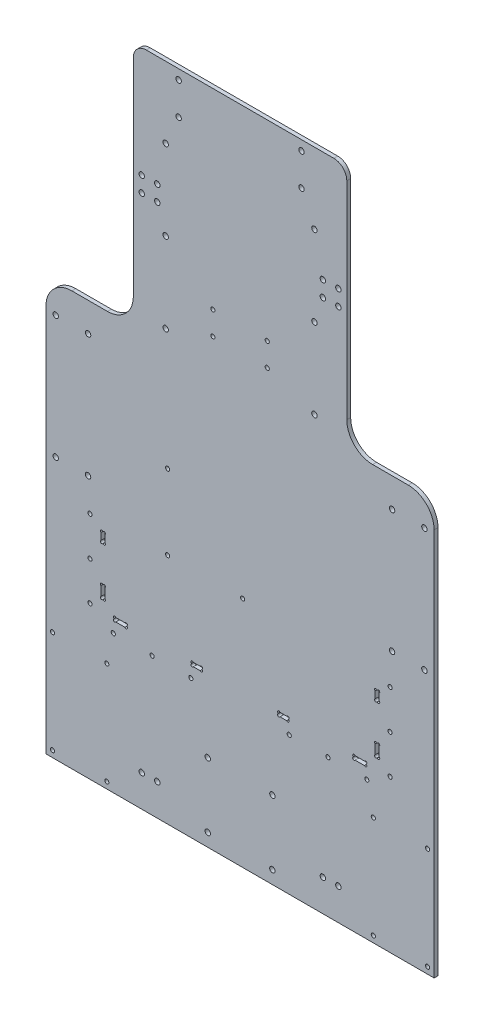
SolidWorks part; units mm, degrees
ref_plane "前视基准面" through (0, 0, 0) normal (0, 0, 1) x (1, 0, 0)
ref_plane "上视基准面" through (0, 0, 0) normal (0, 1, 0) x (1, 0, 0)
ref_plane "右视基准面" through (0, 0, 0) normal (1, 0, 0) x (0, 0, -1)
sketch "草图1" plane through (0, 0, 0) normal (0, 0, 1) x (1, 0, 0)
  line L1 (-82.5, -255) -> (82.5, -255)
  line L2 (-82.5, -255) -> (-82.5, 255)
  line L3 (-82.5, 255) -> (82.5, 255)
  line L4 (82.5, -255) -> (82.5, 255)
  line L5 (-82.5, -255) -> (82.5, 255) construction
  line L6 (-82.5, 255) -> (82.5, -255) construction
  point P0 (0, 0)
  dimension "D1" = 510
  dimension "D2" = 165
extrude "凸台-拉伸1" add sketch "草图1" along normal blind 3
hole_wizard "Ø4.2 (4.2) 直径孔1" positions "草图2" profile "草图3" hole size "Ø4.2" standard "GB"
sketch "草图2" plane through (0, 0, 3) normal (0, 0, 1) x (1, 0, 0)
  line L0 (0, 255) -> (0, -255) construction
  line L1 (82.5, 255) -> (-82.5, 255) construction
  line L2 (-82.5, -255) -> (82.5, -255) construction
  point P9 (25, -245)
  point P12 (25, -195)
  point P16 (-25, -195)
  point P17 (-25, -245)
  dimension "D1" = 10
  dimension "D2" = 50
  dimension "D3" = 50
sketch "草图3" plane through (-25, -245, 3) normal (1, 0, 0) x (0, -1, 0)
  line L0 (0, 0) -> (0, 3)
  line L1 (0, 3) -> (2.1, 3)
  line L2 (2.1, 3) -> (2.1, 0)
  line L5 (2.1, 0) -> (0, 0)
  line L11 (0, -6.35) -> (0, 107.95) construction
  dimension "通孔孔直径" = 4.2
  dimension "通孔孔深度" = 3
hole_wizard "Ø4.2 (4.2) 直径孔2" positions "草图4" profile "草图5" hole size "Ø4.2" standard "GB"
sketch "草图4" plane through (0, 0, 3) normal (0, 0, 1) x (1, 0, 0)
  line L0 (0, 255) -> (0, -255) construction
  line L1 (82.5, 255) -> (-82.5, 255) construction
  line L2 (-82.5, -255) -> (82.5, -255) construction
  point P8 (-47.5, 247.5)
  point P11 (-47.5, 222.5)
  point P15 (47.5, 222.5)
  point P16 (47.5, 247.5)
  dimension "D1" = 95
  dimension "D2" = 7.5
  dimension "D3" = 25
sketch "草图5" plane through (47.5, 247.5, 3) normal (1, 0, 0) x (0, -1, 0)
  line L0 (0, 0) -> (0, 3)
  line L1 (0, 3) -> (2.1, 3)
  line L2 (2.1, 3) -> (2.1, 0)
  line L5 (2.1, 0) -> (0, 0)
  line L11 (0, -6.35) -> (0, 107.95) construction
  dimension "通孔孔直径" = 4.2
  dimension "通孔孔深度" = 3
sketch "草图6" plane through (0, 0, 3) normal (0, 0, 1) x (1, 0, 0)
  line L0 (0, 255) -> (0, -255) construction
  line L1 (-82.5, -255) -> (-150, -255)
  line L2 (-82.5, -255) -> (-82.5, 65)
  line L3 (-82.5, 65) -> (-150, 65)
  line L4 (-150, -255) -> (-150, 65)
  line L5 (82.5, 255) -> (-82.5, 255) construction
  line L6 (-82.5, -255) -> (82.5, -255) construction
  line L7 (150, -255) -> (150, 65)
  line L8 (82.5, 65) -> (150, 65)
  line L9 (82.5, -255) -> (82.5, 65)
  line L10 (82.5, -255) -> (150, -255)
  dimension "D1" = 320
  dimension "D2" = 300
extrude "凸台-拉伸2" add sketch "草图6" against normal blind 3
hole_wizard "Ø4.2 (4.2) 直径孔3" positions "草图9" profile "草图10" hole size "Ø4.2" standard "GB"
sketch "草图9" plane through (0, 0, 3) normal (0, 0, 1) x (1, 0, 0)
  line L0 (-150, -5) -> (150, -5) construction
  line L1 (-150, 65) -> (-150, -255) construction
  line L2 (150, -255) -> (150, 65) construction
  line L4 (-150, -255) -> (150, -255) construction
  line L5 (0, 255) -> (0, -255) construction
  line L6 (82.5, 255) -> (-82.5, 255) construction
  point P11 (-142.5, 42.5)
  point P19 (-142.5, -52.5)
  point P20 (-117.5, 42.5)
  point P25 (-117.5, -52.5)
  point P26 (117.5, -52.5)
  point P27 (117.5, 42.5)
  point P28 (142.5, -52.5)
  point P29 (142.5, 42.5)
  dimension "D1" = 250
  dimension "D2" = 95
  dimension "D3" = 285
  dimension "D4" = 25
sketch "草图10" plane through (142.5, 42.5, 3) normal (1, 0, 0) x (0, -1, 0)
  line L0 (0, 0) -> (0, 3)
  line L1 (0, 3) -> (2.1, 3)
  line L2 (2.1, 3) -> (2.1, 0)
  line L5 (2.1, 0) -> (0, 0)
  line L11 (0, -6.35) -> (0, 107.95) construction
  dimension "通孔孔直径" = 4.2
  dimension "通孔孔深度" = 3
hole_wizard "Ø4.2 (4.2) 直径孔4" positions "草图11" profile "草图12" hole size "Ø4.2" standard "GB"
sketch "草图11" plane through (0, 0, 3) normal (0, 0, 1) x (1, 0, 0)
  line L0 (0, 255) -> (0, -255) construction
  line L1 (82.5, 255) -> (-82.5, 255) construction
  line L2 (-150, -255) -> (150, -255) construction
  line L4 (-150, -230.5) -> (150, -230.5) construction
  line L5 (-150, 65) -> (-150, -255) construction
  line L6 (150, -255) -> (150, 65) construction
  point P17 (76, -230.5)
  point P20 (64, -230.5)
  point P23 (-64, -230.5)
  point P24 (-76, -230.5)
  point P25 (76, 169.5)
  point P29 (64, 169.5)
  point P31 (-64, 169.5)
  point P33 (-76, 169.5)
  point P35 (76, 157.5)
  point P39 (-76, 157.5)
  point P40 (-64, 157.5)
  point P42 (64, 157.5)
  dimension "D1" = 24.5
  dimension "D2" = 152
  dimension "D3" = 128
  dimension "D4" = 400
  dimension "D5" = 12
sketch "草图12" plane through (64, 157.5, 3) normal (1, 0, 0) x (0, -1, 0)
  line L0 (0, 0) -> (0, 3)
  line L1 (0, 3) -> (2.1, 3)
  line L2 (2.1, 3) -> (2.1, 0)
  line L5 (2.1, 0) -> (0, 0)
  line L11 (0, -6.35) -> (0, 107.95) construction
  dimension "通孔孔直径" = 4.2
  dimension "通孔孔深度" = 3
hole_wizard "Ø4.2 (4.2) 直径孔5" positions "草图13" profile "草图14" hole size "Ø4.2" standard "GB"
sketch "草图13" plane through (0, 0, 3) normal (0, 0, 1) x (1, 0, 0)
  line L0 (0, 255) -> (0, -255) construction
  line L1 (82.5, 255) -> (-82.5, 255) construction
  line L2 (-150, -255) -> (150, -255) construction
  point P9 (57.5, 200)
  point P12 (57.5, 138)
  point P16 (57.5, 76)
  point P19 (-57.5, 76)
  point P20 (-57.5, 138)
  point P21 (-57.5, 200)
  dimension "D1" = 55
  dimension "D2" = 115
  dimension "D3" = 62
  dimension "D4" = 62
sketch "草图14" plane through (-57.5, 200, 3) normal (1, 0, 0) x (0, -1, 0)
  line L0 (0, 0) -> (0, 3)
  line L1 (0, 3) -> (2.1, 3)
  line L2 (2.1, 3) -> (2.1, 0)
  line L5 (2.1, 0) -> (0, 0)
  line L11 (0, -6.35) -> (0, 107.95) construction
  dimension "通孔孔直径" = 4.2
  dimension "通孔孔深度" = 3
hole_wizard "Ø3.2 (3.2) 直径孔1" positions "草图15" profile "草图16" hole size "Ø3.2" standard "GB"
sketch "草图15" plane through (0, 0, 3) normal (0, 0, 1) x (1, 0, 0)
  point P0 (2, -75)
  point P3 (-56, -75)
  point P6 (-56, -17)
sketch "草图16" plane through (2, -75, 3) normal (1, 0, 0) x (0, -1, 0)
  line L0 (0, 0) -> (0, 3)
  line L1 (0, 3) -> (1.6, 3)
  line L2 (1.6, 3) -> (1.6, 0)
  line L5 (1.6, 0) -> (0, 0)
  line L11 (0, -6.35) -> (0, 107.95) construction
  dimension "通孔孔直径" = 3.2
  dimension "通孔孔深度" = 3
hole_wizard "Ø3.2 (3.2) 直径孔2" positions "草图17" profile "草图18" hole size "Ø3.2" standard "GB"
sketch "草图17" plane through (0, 0, 3) normal (0, 0, 1) x (1, 0, 0)
  point P4 (21, 89)
  point P7 (21, 107)
  point P14 (-21, 89)
  point P17 (-21, 107)
sketch "草图18" plane through (21, 89, 3) normal (1, 0, 0) x (0, -1, 0)
  line L0 (0, 0) -> (0, 3)
  line L1 (0, 3) -> (1.6, 3)
  line L2 (1.6, 3) -> (1.6, 0)
  line L5 (1.6, 0) -> (0, 0)
  line L11 (0, -6.35) -> (0, 107.95) construction
  dimension "通孔孔直径" = 3.2
  dimension "通孔孔深度" = 3
sketch "草图19" plane through (0, 0, 0) normal (0, 0, -1) x (-1, 0, 0)
  line L1 (104.5, -84.2) -> (107.5, -84.2)
  line L2 (104.5, -84.2) -> (104.5, -92.2)
  line L3 (104.5, -92.2) -> (107.5, -92.2)
  line L4 (107.5, -84.2) -> (107.5, -92.2)
  line L5 (104.5, -119.7) -> (107.5, -119.7)
  line L6 (104.5, -119.7) -> (104.5, -129.7)
  line L7 (104.5, -129.7) -> (107.5, -129.7)
  line L8 (107.5, -119.7) -> (107.5, -129.7)
  line L9 (87.5, -136.7) -> (97.5, -136.7)
  line L10 (87.5, -136.7) -> (87.5, -139.7)
  line L11 (87.5, -139.7) -> (97.5, -139.7)
  line L12 (97.5, -136.7) -> (97.5, -139.7)
  line L13 (29.5, -136.7) -> (37.5, -136.7)
  line L14 (29.5, -136.7) -> (29.5, -139.7)
  line L15 (29.5, -139.7) -> (37.5, -139.7)
  line L16 (37.5, -136.7) -> (37.5, -139.7)
  line L17 (-104.5, -84.2) -> (-107.5, -84.2)
  line L18 (-104.5, -84.2) -> (-104.5, -92.2)
  line L19 (-104.5, -92.2) -> (-107.5, -92.2)
  line L20 (-107.5, -84.2) -> (-107.5, -92.2)
  line L21 (-97.5, -136.7) -> (-87.5, -136.7)
  line L22 (-97.5, -136.7) -> (-97.5, -139.7)
  line L23 (-97.5, -139.7) -> (-87.5, -139.7)
  line L24 (-87.5, -136.7) -> (-87.5, -139.7)
  line L25 (-107.5, -119.7) -> (-104.5, -119.7)
  line L26 (-107.5, -119.7) -> (-107.5, -129.7)
  line L27 (-107.5, -129.7) -> (-104.5, -129.7)
  line L28 (-104.5, -119.7) -> (-104.5, -129.7)
  line L29 (-37.5, -139.7) -> (-29.5, -139.7)
  line L30 (-37.5, -139.7) -> (-37.5, -136.7)
  line L31 (-37.5, -136.7) -> (-29.5, -136.7)
  line L32 (-29.5, -139.7) -> (-29.5, -136.7)
extrude "切除-拉伸1" cut sketch "草图19" against normal blind 10
sketch "草图20" plane through (0, 0, 3) normal (0, 0, 1) x (1, 0, 0)
  circle A0 centre (116, -77.2) radius 1.6
  circle A1 centre (116, -107.2) radius 1.6
  circle A2 centre (116, -137.2) radius 1.6
  circle A3 centre (98, -148.2) radius 1.6
  circle A4 centre (68, -148.2) radius 1.6
  circle A5 centre (38, -148.2) radius 1.6
  dimension "D1" = 3.2
  dimension "D2" = 30
extrude "切除-拉伸2" cut sketch "草图20" against normal through all
mirror "镜向1" about plane through (0, 0, 0) normal (1, 0, 0) of "切除-拉伸2"
sketch "草图21" plane through (0, 0, 3) normal (0, 0, 1) x (1, 0, 0)
  line L0 (150, -255) -> (150, 65) construction
  line L1 (103, -250) -> (145, -250) construction
  line L2 (103, -250) -> (103, -171) construction
  line L3 (103, -171) -> (145, -171) construction
  line L4 (145, -250) -> (145, -171) construction
  line L5 (-150, -255) -> (150, -255) construction
  circle A0 centre (103, -171) radius 1.6
  circle A1 centre (145, -171) radius 1.6
  circle A2 centre (103, -250) radius 1.6
  circle A3 centre (145, -250) radius 1.6
  dimension "D5" = 3.2
  dimension "D1" = 42
  dimension "D2" = 79
  dimension "D3" = 5
  dimension "D4" = 5
extrude "切除-拉伸3" cut sketch "草图21" against normal through all
mirror "镜向2" about plane through (0, 0, 0) normal (1, 0, 0) of "切除-拉伸3"
fillet "圆角1" radius 20 4 edges at (150, 65, 1.5) (-150, 65, 1.5) (82.5, 65, 1.5) (-82.5, 65, 1.5)
sketch "草图22" plane through (0, 0, 3) normal (0, 0, 1) x (1, 0, 0)
  line L0 (97.5, -136.7) -> (97.5, -139.7) construction
  line L1 (87.5, -136.7) -> (97.5, -136.7) construction
  line L2 (97.5, -139.7) -> (87.5, -139.7) construction
  line L3 (87.5, -139.7) -> (87.5, -136.7) construction
  circle A0 centre (97, -137.2) radius 1
  circle A1 centre (97, -139.2) radius 1
  circle A2 centre (88.0877, -137.2) radius 1
  circle A3 centre (88.0877, -139.2) radius 1
  dimension "D1" = 2
  dimension "D3" = 0.5
  dimension "D2" = 0.5
  dimension "D4" = 0.5
  dimension "D5" = 0.5877
extrude "切除-拉伸4" cut sketch "草图22" against normal through all contours A1 | A3 | A2 | A0
sketch "草图24" plane through (0, 0, 3) normal (0, 0, 1) x (1, 0, 0)
  line L0 (104.5, -129.7) -> (104.5, -119.7) construction
  line L1 (107.5, -129.7) -> (104.5, -129.7) construction
  line L2 (107.5, -119.7) -> (107.5, -129.7) construction
  line L3 (104.5, -119.7) -> (107.5, -119.7) construction
  circle A0 centre (105, -129.2) radius 1
  circle A1 centre (107, -129.2) radius 1
  circle A2 centre (105, -120.2) radius 1
  circle A3 centre (107, -120.2) radius 1
  dimension "D1" = 2
  dimension "D5" = 0.5
  dimension "D2" = 0.5
  dimension "D3" = 0.5
  dimension "D4" = 0.5
extrude "切除-拉伸5" cut sketch "草图24" against normal blind 10 contours A2 | A3 | A1 | A0
sketch "草图25" plane through (0, 0, 3) normal (0, 0, 1) x (1, 0, 0)
  line L1 (104.5, -92.2) -> (104.5, -84.2) construction
  line L2 (107.5, -92.2) -> (104.5, -92.2) construction
  line L3 (107.5, -84.2) -> (107.5, -92.2) construction
  line L4 (104.5, -84.2) -> (107.5, -84.2) construction
  circle A0 centre (105, -84.7) radius 1
  circle A1 centre (107, -84.7) radius 1
  circle A2 centre (105, -91.7) radius 1
  circle A3 centre (107, -91.7) radius 1
  dimension "D4" = 2
  dimension "D1" = 0.5
  dimension "D2" = 0.5
  dimension "D3" = 0.5
  dimension "D5" = 0.5
extrude "切除-拉伸6" cut sketch "草图25" against normal blind 10 contours A0 | A1 | A3 | A2
sketch "草图26" plane through (0, 0, 3) normal (0, 0, 1) x (1, 0, 0)
  line L0 (29.5, -136.7) -> (37.5, -136.7) construction
  line L2 (29.5, -139.7) -> (29.5, -136.7) construction
  line L3 (37.5, -139.7) -> (29.5, -139.7) construction
  line L5 (37.5, -136.7) -> (37.5, -139.7) construction
  circle A0 centre (37, -137.2) radius 1
  circle A1 centre (37, -139.2) radius 1
  circle A2 centre (30, -137.2) radius 1
  circle A3 centre (30, -139.2) radius 1
  dimension "D1" = 2
  dimension "D2" = 0.5
  dimension "D3" = 0.5
  dimension "D4" = 0.5
  dimension "D5" = 0.5
extrude "切除-拉伸7" cut sketch "草图26" against normal blind 10 contours A2 | A0 | A1 | A3
mirror "镜向3" about plane through (0, 0, 0) normal (1, 0, 0) of "切除-拉伸7", "切除-拉伸6", "切除-拉伸5", "切除-拉伸4"
fillet "圆角2" radius 10 2 edges at (82.5, 255, 1.5) (-82.5, 255, 1.5)
